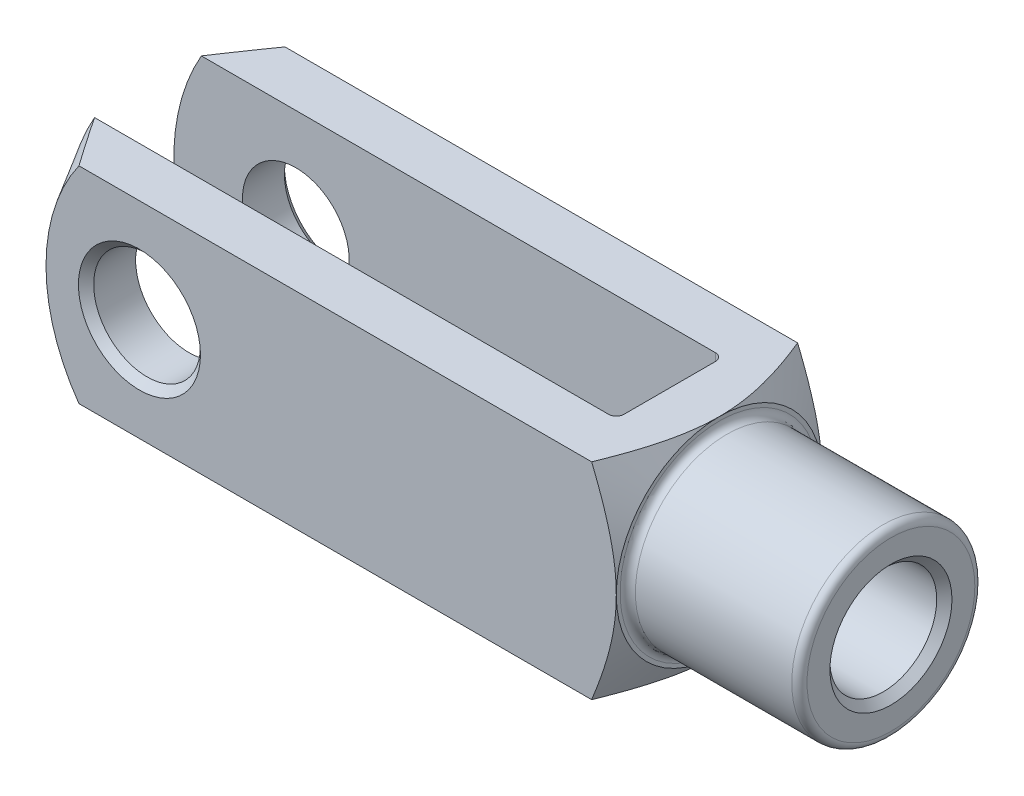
SolidWorks part; units mm, degrees
ref_plane "Front Plane" through (0, 0, 0) normal (0, 0, 1) x (1, 0, 0)
ref_plane "Top Plane" through (0, 0, 0) normal (0, 1, 0) x (1, 0, 0)
ref_plane "Right Plane" through (0, 0, 0) normal (1, 0, 0) x (0, 0, -1)
sketch "Sketch1" plane through (0, 0, 0) normal (1, 0, 0) x (0, 0, -1)
  line L0 (0, 0) -> (0, 50000) construction
  line L1 (0, 0) -> (50000, 0) construction
  line L2 (-13.5, -13.5) -> (-13.5, 13.5)
  line L3 (-13.5, 13.5) -> (13.5, 13.5)
  line L4 (13.5, -13.5) -> (13.5, 13.5)
  line L5 (-13.5, -13.5) -> (13.5, -13.5)
  point P9 (0, 13.5)
  point P11 (13.5, 0)
  point P12 (-13.5, 0)
  dimension "D1" = 27
  dimension "D2" = 27
extrude "Extrude1" add sketch "Sketch1" against normal blind 101
sketch "Sketch2" plane through (0, 0, 0) normal (1, 0, 0) x (0, 0, -1)
  circle A0 centre (0, 0) radius 12
  circle A1 centre (0, 0) radius 24
  dimension "D1" = 24
  dimension "D2" = 48
extrude "Extrude2" cut sketch "Sketch2" against normal blind 22.5
sketch "Sketch3" plane through (0, 0, 13.5) normal (0, 0, 1) x (1, 0, 0)
  circle A0 centre (-85, 0) radius 7
  dimension "D1" = 14
  dimension "D2" = 85
extrude "Extrude3" cut sketch "Sketch3" against normal through all
sketch "Sketch4" plane through (0, 13.5, 0) normal (0, 1, 0) x (1, 0, 0)
  line L0 (0, 0) -> (-50000, 0) construction
  line L1 (-101, -7) -> (-101, 7)
  line L2 (-101, 13.5) -> (-101, -13.5) construction
  line L3 (-101, 7) -> (-29, 7)
  line L4 (-29, 7) -> (-29, -7)
  line L5 (-85, 13.5) -> (-85, -13.5) construction
  line L6 (-101, -7) -> (-29, -7)
  point P7 (-85, 0)
  point P13 (-29, 0)
  point P14 (-101, 0)
  dimension "D1" = 56
  dimension "D2" = 14
extrude "Extrude4" cut sketch "Sketch4" against normal through all
fillet "Fillet1" radius 1 2 edges at (-29, 0, 7) (-29, 0, -7)
fillet "Fillet2" radius 1 2 edges at (0, 0, -12) (-22.5, 0, -12)
chamfer "Chamfer2" distance 1 angle 45 2 edges at (-78, 0, -13.5) (-78, 0, 13.5)
sketch "Sketch6" plane through (0, 0, 0) normal (0, 0, 1) x (1, 0, 0)
  line L0 (-22.5, -13.5) -> (-22.5, -27)
  line L1 (-22.5, -27) -> (-30.2942, -27)
  line L2 (-30.2942, -27) -> (-22.5, -13.5)
  dimension "D1" = 30
  dimension "D2" = 27
revolve "Cut-Revolve1" cut sketch "Sketch6" angle 360 about axis through (-22.5, 0, 0) along (1, 0, 0)
sketch "Sketch7" plane through (0, 0, 0) normal (0, 1, 0) x (1, 0, 0)
  line L0 (-97.2472, -13.5) -> (-101, -7)
  line L1 (-101, 7) -> (-97.2472, 13.5)
  line L2 (-97.2472, 13.5) -> (-128, 13.5)
  line L3 (-101, 7) -> (-101, -7)
  line L4 (-128, 13.5) -> (-128, -13.5)
  line L5 (-128, -13.5) -> (-97.2472, -13.5)
  line L6 (-101, 13.5) -> (-25.7285, 13.5) construction
  line L7 (-101, -13.5) -> (-25.7285, -13.5) construction
  line L8 (-74, 0.6162) -> (-74, 50000.6162) construction
  dimension "D1" = 120
  dimension "D2" = 27
  dimension "D3" = 27
revolve "Cut-Revolve2" cut sketch "Sketch7" angle 180 about L8
sketch "Sketch8" plane through (0, 0, 0) normal (1, 0, 0) x (0, 0, -1)
  circle A0 centre (0, 0) radius 7
  dimension "D1" = 14
extrude "Extrude5" cut sketch "Sketch8" against normal through all
chamfer "Chamfer3" distance 1 angle 45 1 edges at (0, 0, -7)
equation "\"D2@Sketch1\" = \"D1@Sketch1\""
equation "\"D2@Sketch2\" = \"D1@Sketch2\"*2"
equation "\"D2@Sketch6\" = \"D1@Sketch1\""
equation "\"D2@Sketch7\" = \"D1@Sketch1\""
equation "\"D3@Sketch7\" = \"D1@Sketch1\""
